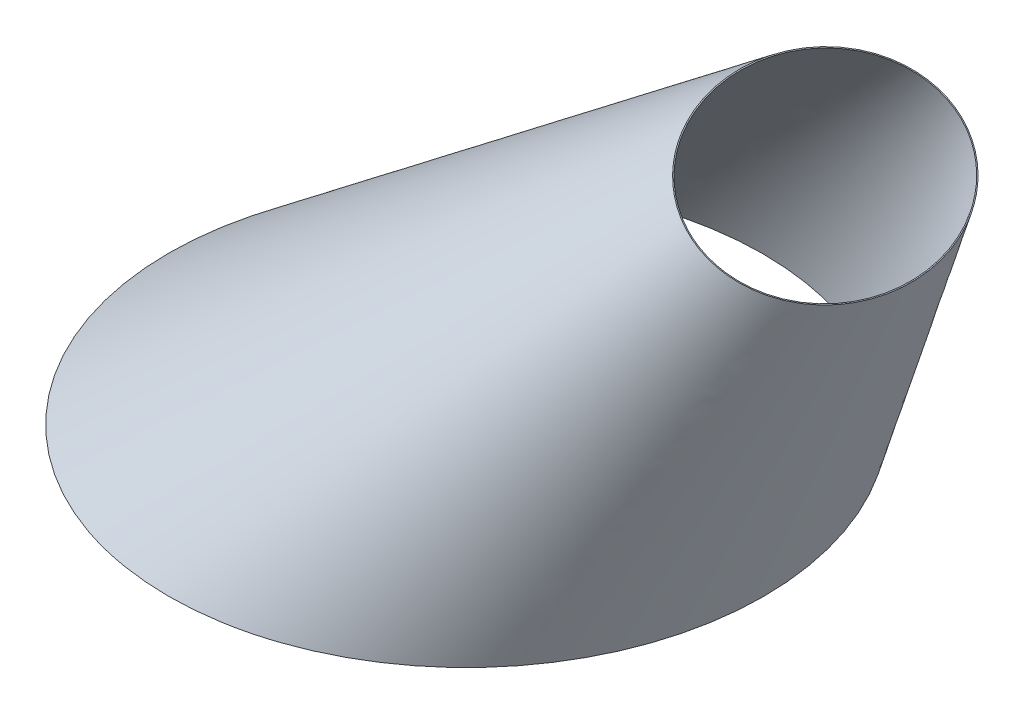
SolidWorks part; units mm, degrees
ref_plane "前视基准面" through (0, 0, 0) normal (0, 0, 1) x (1, 0, 0)
ref_plane "上视基准面" through (0, 0, 0) normal (0, 1, 0) x (1, 0, 0)
ref_plane "右视基准面" through (0, 0, 0) normal (1, 0, 0) x (0, 0, -1)
sketch "草图1" plane through (0, 0, 0) normal (0, 1, 0) x (1, 0, 0)
  line L0 (-300, 0) -> (300, 0) construction
  circle A0 centre (0, 0) radius 300
  dimension "D" = 600
sketch "草图2" plane through (0, 0, 0) normal (0, 0, 1) x (1, 0, 0)
  line L0 (-300, 0) -> (598.5324, 700) construction
  line L1 (598.5324, 700) -> (300, 0) construction
  line L2 (0, 0) -> (598.5324, 700) construction
  line L3 (275.6033, 448.4227) -> (1052.2943, 0)
  line L4 (1052.2943, 0) -> (0, 0) construction
  line L5 (222.1078, 406.7471) -> (347.7876, 406.7471) construction
  dimension "H" = 700
  dimension "lm" = 921
  dimension "l" = 535.163
  dimension "φ" = 30
sketch "草图3" plane through (0, 0, 0) normal (0, 0, 1) x (1, 0, 0)
  point P0 (598.5324, 700)
loft "放样1" add profiles "草图1", "草图3"
extrude "切除-拉伸1" cut sketch "草图2" against normal through all and the other way through all
shell "抽壳1"
